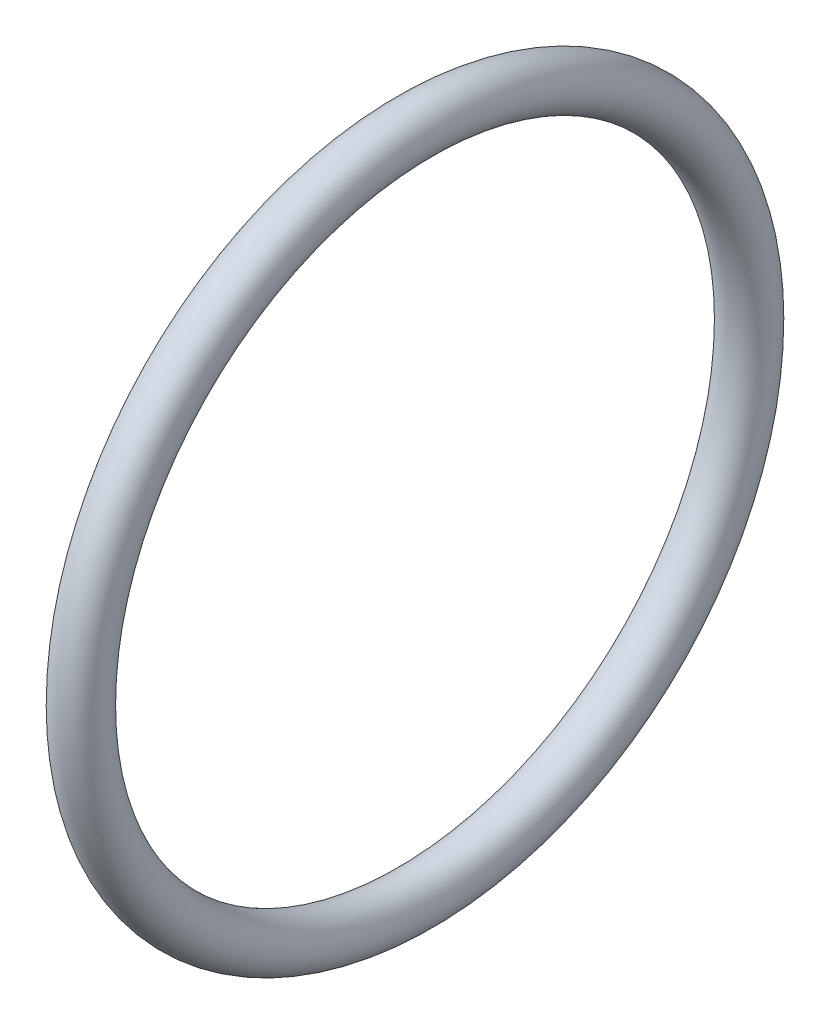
SolidWorks part; units mm, degrees
ref_plane "FRONT" through (0, 0, 0) normal (0, 0, 1) x (1, 0, 0)
ref_plane "TOP" through (0, 0, 0) normal (0, 1, 0) x (1, 0, 0)
ref_plane "SIDE" through (0, 0, 0) normal (1, 0, 0) x (0, 0, -1)
sketch "Sketch1" plane through (0, 0, 0) normal (0, 0, 1) x (1, 0, 0)
  line L0 (0, 0) -> (15.24, 0) construction
  circle A0 centre (0, 17.8054) radius 1.3081
  dimension "D1" = 2.6162
  dimension "D2" = 32.9946
revolve "Base-Revolve" add sketch "Sketch1" angle 360 about L0
